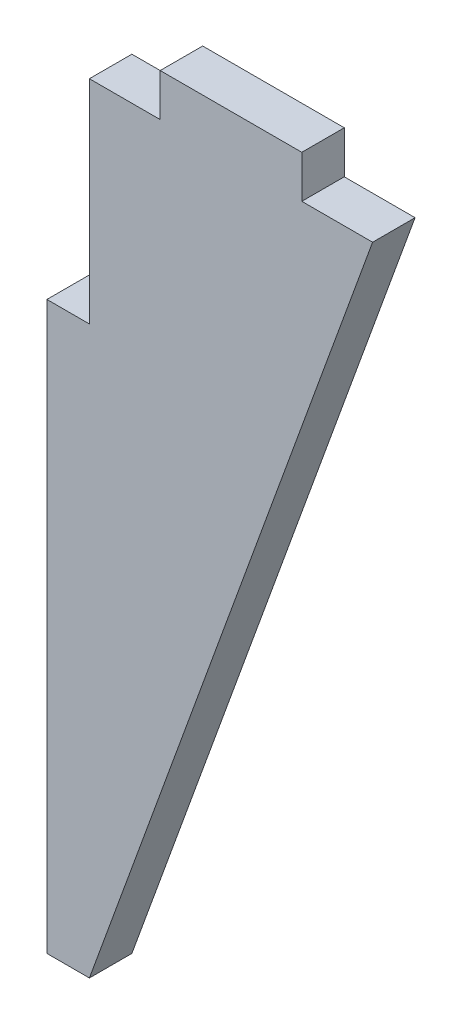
SolidWorks part; units mm, degrees
ref_plane "Plan de face" through (0, 0, 0) normal (0, 0, 1) x (1, 0, 0)
ref_plane "Plan de dessus" through (0, 0, 0) normal (0, 1, 0) x (1, 0, 0)
ref_plane "Plan de droite" through (0, 0, 0) normal (1, 0, 0) x (0, 0, -1)
sketch "Esquisse1" plane through (0, 0, 0) normal (0, 0, 1) x (1, 0, 0)
  line L0 (-67, -55) -> (-70, -55) construction
  line L1 (-67, -15) -> (-70, -15) construction
  line L3 (-67, -55) -> (-70, -55)
  line L4 (-67, -15) -> (-70, -15)
  line L5 (-47, 0) -> (-52, 0)
  line L6 (-67, -55) -> (-47, 0)
  line L7 (-67, -15) -> (-67, 0)
  line L8 (-70, -55) -> (-70, -15)
  line L9 (100, 0) -> (-100, 0) construction
  line L10 (-52, 0) -> (-52, 3)
  line L11 (-52, 3) -> (-62, 3)
  line L12 (-62, 3) -> (-62, 0)
  line L13 (-62, 0) -> (-67, 0)
  line L14 (100, 3) -> (-100, 3) construction
  dimension "D1" = 20
  dimension "D2" = 10
  dimension "D3" = 5
extrude "Boss.-Extru.1" add sketch "Esquisse1" along normal up to surface (3 mm away)
